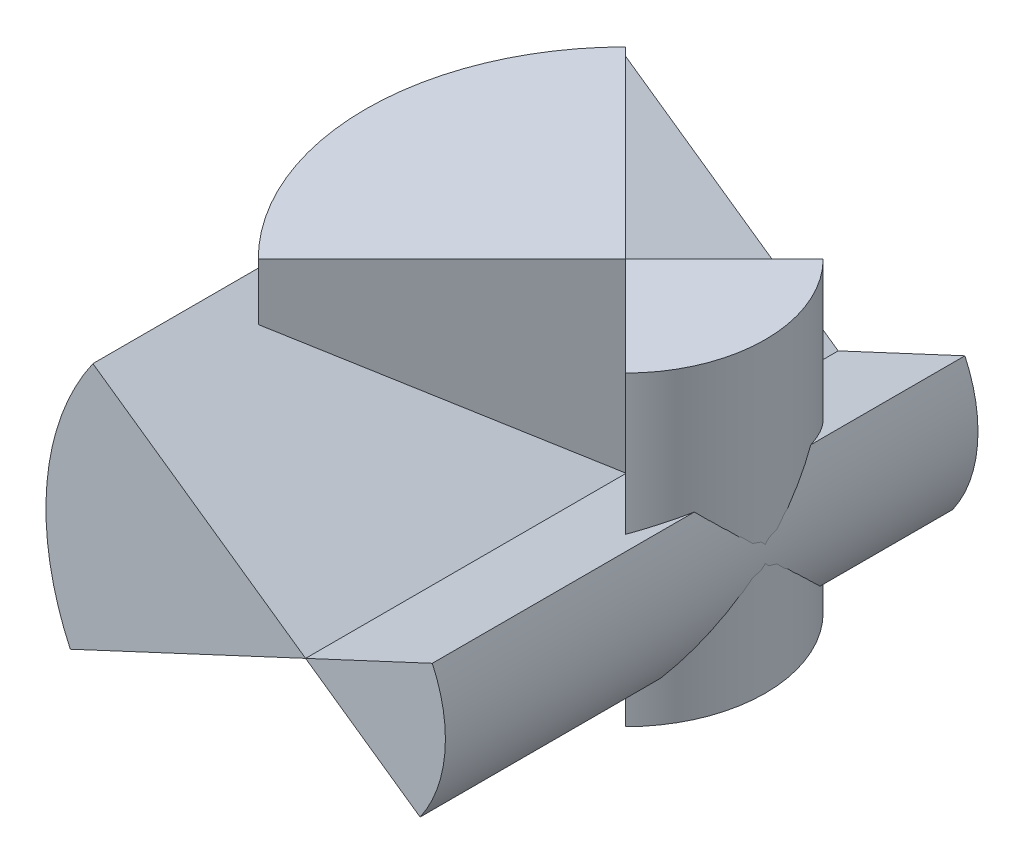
SolidWorks part; units mm, degrees
ref_plane "前视基准面" through (0, 0, 0) normal (0, 0, 1) x (1, 0, 0)
ref_plane "上视基准面" through (0, 0, 0) normal (0, 1, 0) x (1, 0, 0)
ref_plane "右视基准面" through (0, 0, 0) normal (1, 0, 0) x (0, 0, -1)
sketch "草图1" plane through (0, 24.4202, 0) normal (0, 1, 0) x (1, 0, 0)
  line L0 (-0.2729, 66.5) -> (-0.2729, 14.5) construction
  line L1 (-15.9588, 66.5) -> (15.4129, 66.5) construction
  line L2 (15.4129, 14.5) -> (-15.9588, 14.5) construction
  line L3 (-0.2729, 40.5) -> (-219.6989, 40.5) construction
  line L4 (-0.2729, 40.5) -> (-138.1587, 178.3858)
  line L5 (-0.2729, 40.5) -> (73.9733, -33.7462)
  line L6 (-0.2729, 40.5) -> (73.9733, 114.7462)
  line L7 (-0.2729, 40.5) -> (-138.1587, -97.3858)
  arc A0 (-138.1587, 178.3858) -> (-138.1587, -97.3858) centre (-0.2729, 40.5) ccw
  arc A1 (73.9733, -33.7462) -> (73.9733, 114.7462) centre (-0.2729, 40.5) ccw
  point P8 (-0.2729, 40.5)
  dimension "D2" = 195
  dimension "D3" = 105
  dimension "D1" = 90
sketch "草图2" plane through (0, 0, 0) normal (0, 0, 1) x (1, 0, 0)
  line L0 (0, 0) -> (-218.3876, 0) construction
  line L1 (0, 0) -> (-159.7346, 111.8474)
  line L2 (0, 0) -> (86.011, -60.2255)
  line L3 (0, 0) -> (-176.73, -82.4106)
  line L4 (0, 0) -> (95.1623, 44.3749)
  arc A0 (-159.7346, 111.8474) -> (-176.73, -82.4106) centre (0, 0) ccw
  arc A1 (86.011, -60.2255) -> (95.1623, 44.3749) centre (0, 0) ccw
  dimension "D1" = 195
  dimension "D2" = 105
  dimension "D3" = 35
  dimension "D4" = 25
extrude "凸台-拉伸1" add sketch "草图1" along normal mid plane 230 contours L4 A0 L7 | L5 A1 L6
extrude "凸台-拉伸2" add sketch "草图2" along normal mid plane 400 separate body contours L1 A0 L3 | L4 A1 L2
